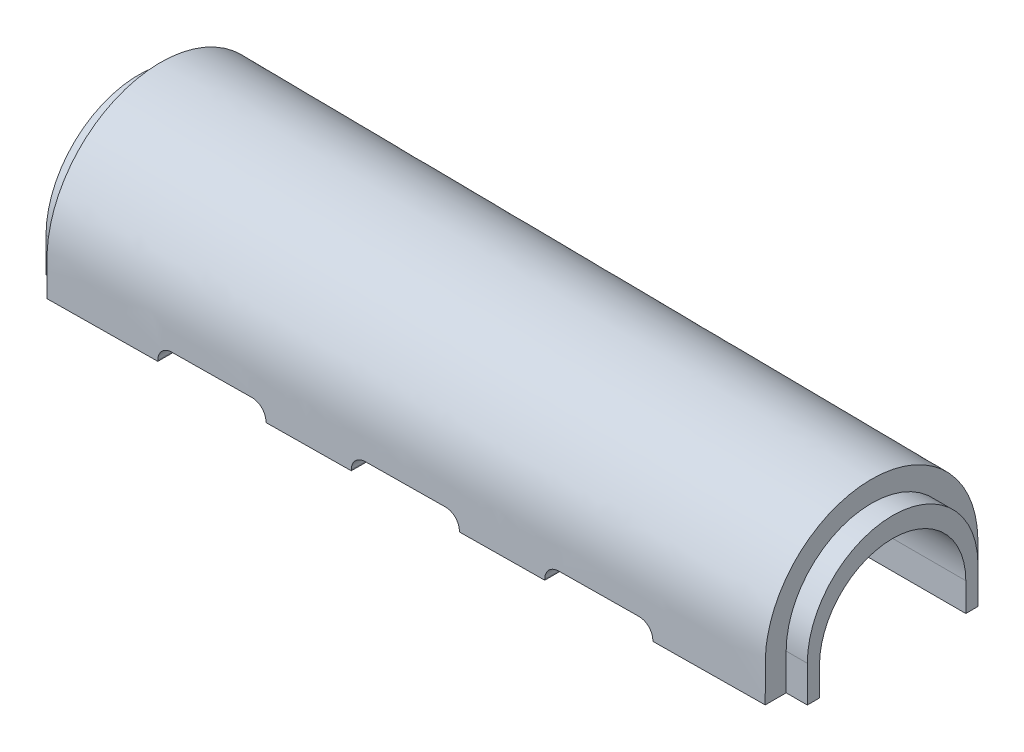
SolidWorks part; units mm, degrees
ref_plane "Front Plane" through (0, 0, 0) normal (0, 0, 1) x (1, 0, 0)
ref_plane "Top Plane" through (0, 0, 0) normal (0, 1, 0) x (1, 0, 0)
ref_plane "Right Plane" through (0, 0, 0) normal (1, 0, 0) x (0, 0, -1)
sketch "Sketch1" plane through (0, 0, 0) normal (1, 0, 0) x (0, 0, -1)
  line L1 (0, 0) -> (35.56, 0)
  line L2 (0, 0) -> (0, 5.3467)
  line L4 (35.56, 0) -> (35.56, 5.3467)
  arc A0 (0, 5.3467) -> (35.56, 5.3467) centre (17.78, 5.3467) cw
  point P6 (17.78, 23.1267)
  dimension "D2" = 23.1267
  dimension "D1" = 35.56
ref_plane "Plane1" through (117.6909, 0, 0) normal (1, 0, 0) x (0, 0, -1)
sketch "Sketch2" plane through (117.6909, 0, 0) normal (1, 0, 0) x (0, 0, -1)
  line L0 (0, 0) -> (35.56, 0) construction
  line L1 (1.2065, 0) -> (34.3535, 0)
  line L2 (1.2065, 0) -> (1.2065, 5.6515)
  line L4 (34.3535, 0) -> (34.3535, 5.6515)
  arc A0 (1.2065, 5.6515) -> (34.3535, 5.6515) centre (17.78, 5.6515) cw
  point P8 (17.78, 22.225)
  dimension "D1" = 33.147
  dimension "D2" = 16.5735
  dimension "D3" = 22.225
loft "Loft1" add profiles "Sketch1", "Sketch2"
sketch "Sketch3" plane through (0, 0, 0) normal (0, 0, 1) x (1, 0, 0)
  line L5 (20.447, -0.889) -> (37.1602, -0.889)
  line L14 (37.1602, -0.889) -> (37.1602, 0.1524)
  line L15 (22.606, 2.3114) -> (35.0012, 2.3114)
  line L16 (20.447, -0.889) -> (20.447, 0.1524)
  line L17 (50.3682, -0.889) -> (67.0814, -0.889)
  line L18 (67.0814, -0.889) -> (67.0814, 0.1524)
  line L19 (52.5272, 2.3114) -> (64.9224, 2.3114)
  line L20 (50.3682, -0.889) -> (50.3682, 0.1524)
  line L21 (80.2894, -0.889) -> (97.0026, -0.889)
  line L22 (97.0026, -0.889) -> (97.0026, 0.1524)
  line L23 (82.4484, 2.3114) -> (94.8436, 2.3114)
  line L24 (80.2894, -0.889) -> (80.2894, 0.1524)
  arc A6 (37.1602, 0.1524) -> (35.0012, 2.3114) centre (35.0012, 0.1524) ccw
  arc A7 (20.447, 0.1524) -> (22.606, 2.3114) centre (22.606, 0.1524) cw
  arc A8 (64.9224, 2.3114) -> (67.0814, 0.1524) centre (64.9224, 0.1524) cw
  arc A9 (50.3682, 0.1524) -> (52.5272, 2.3114) centre (52.5272, 0.1524) cw
  arc A10 (94.8436, 2.3114) -> (97.0026, 0.1524) centre (94.8436, 0.1524) cw
  arc A11 (80.2894, 0.1524) -> (82.4484, 2.3114) centre (82.4484, 0.1524) cw
  point P17 (96.1136, 1.4224)
  point P20 (81.1784, 1.4224)
  point P23 (66.1924, 1.4224)
  point P26 (51.2572, 1.4224)
  point P32 (21.336, 1.4224)
  dimension "D2" = 14.9352
  dimension "D3" = 14.9352
  dimension "D7" = 21.336
extrude "Cut-Extrude1" cut sketch "Sketch3" against normal through all
sketch "Sketch4" plane through (117.6909, 0, 0) normal (1, 0, 0) x (0, 0, -1)
  line L0 (1.2065, 0) -> (34.3535, 0) construction
  line L1 (4.445, 0) -> (32.6771, 0)
  line L2 (2.8829, 0) -> (2.8829, 0.9776)
  line L3 (2.8829, 0) -> (34.3535, 0)
  line L4 (1.2065, 0) -> (34.3535, 0)
  line L5 (4.445, 5.6515) -> (4.445, 3.2385)
  line L6 (4.445, 0) -> (34.3535, 0)
  line L7 (31.115, 3.2385) -> (31.115, 5.6515)
  line L8 (1.2065, 5.6515) -> (1.2065, 0)
  line L9 (1.2065, 0) -> (34.3535, 0)
  line L10 (34.3535, 0) -> (34.3535, 5.6515)
  line L11 (1.2065, 5.6515) -> (1.2065, 0)
  line L13 (34.3535, 0) -> (34.3535, 5.6515)
  line L14 (4.445, 3.2385) -> (4.445, 0)
  line L15 (4.445, 0) -> (31.115, 0)
  line L16 (31.115, 0) -> (31.115, 3.2385)
  line L17 (1.2065, 30.7745) -> (34.3535, 30.7745)
  line L18 (4.445, 3.2385) -> (31.115, 3.2385) construction
  line L19 (1.2065, 0) -> (34.3535, 0) construction
  line L22 (1.2065, 30.7745) -> (-1.6423, 30.7745)
  line L23 (1.2065, 5.6515) -> (1.2065, -4.8786)
  line L25 (1.2065, -4.8786) -> (-1.6423, -4.8786)
  line L26 (-1.6423, 30.7745) -> (-1.6423, -4.8786)
  line L27 (34.3535, 30.7745) -> (47.717, 30.7745)
  line L28 (34.3535, 5.6515) -> (34.3535, -4.8786)
  line L29 (34.3535, -4.8786) -> (47.717, -4.8786)
  line L30 (47.717, 30.7745) -> (47.717, -4.8786)
  arc A0 (34.3535, 5.6515) -> (1.2065, 5.6515) centre (17.78, 5.6515) ccw construction
  arc A1 (31.115, 5.6515) -> (4.445, 5.6515) centre (17.78, 5.6515) ccw
  arc A2 (34.3535, 5.6515) -> (1.2065, 5.6515) centre (17.78, 5.6515) ccw
  arc A5 (34.3535, 5.6515) -> (1.2065, 5.6515) centre (17.78, 5.6515) ccw construction
  point P0 (17.78, 22.225)
  dimension "D2" = 14.8971
  dimension "D3" = 0
  dimension "D4" = 3.2385
extrude "Cut-Extrude4" cut sketch "Sketch4" against normal blind 3.302
sketch "Sketch5" plane through (117.6909, 0, 0) normal (1, 0, 0) x (0, 0, -1)
  line L0 (4.445, 0) -> (31.115, 0) construction
  line L1 (6.35, 0) -> (29.21, 0)
  line L2 (6.35, 0) -> (6.35, 4.445)
  line L4 (29.21, 0) -> (29.21, 4.445)
  arc A0 (31.115, 5.6515) -> (4.445, 5.6515) centre (17.78, 5.6515) ccw construction
  arc A1 (6.35, 4.445) -> (29.21, 4.445) centre (17.78, 4.445) cw
  point P6 (17.78, 18.9865)
  point P11 (17.78, 15.875)
  dimension "D1" = 11.43
  dimension "D2" = 22.86
  dimension "D3" = 15.875
extrude "Cut-Extrude5" cut sketch "Sketch5" against normal through all
ref_plane "Plane2" through (0, 0, 0) normal (-1, 0, 0) x (0, 0, 1)
sketch "Sketch6" plane through (0, 0, 0) normal (-1, 0, 0) x (0, 0, 1)
  line L0 (-32.1434, 5.3472) -> (-32.1434, 0)
  line L1 (-29.21, 0) -> (-35.56, 0) construction
  line L2 (-3.1874, 5.3472) -> (-3.1874, 0)
  line L3 (0, 0) -> (-6.35, 0) construction
  line L4 (-32.1434, 0) -> (-32.1434, -4.0465)
  line L5 (-32.1434, -4.0465) -> (-40.3732, -4.0465)
  line L6 (-40.3732, -4.0465) -> (-40.3732, 27.6268)
  line L7 (-40.3732, 27.6268) -> (4.0188, 27.6268)
  line L8 (4.0188, 27.6268) -> (4.0188, -4.0465)
  line L9 (4.0188, -4.0465) -> (-3.1874, -4.0465)
  line L10 (-3.1874, -4.0465) -> (-3.1874, 0)
  arc A0 (0, 5.3467) -> (-35.56, 5.3467) centre (-17.78, 5.3467) ccw construction
  arc A1 (-32.1434, 5.3472) -> (-3.1874, 5.3472) centre (-17.6654, 5.3472) cw
  point P0 (-17.78, 23.1267)
  point P1 (-17.78, 19.8247)
  point P17 (-35.56, 0)
  dimension "D1" = 3.302
  dimension "D2" = 28.956
  dimension "D3" = 14.5926
extrude "Cut-Extrude6" cut sketch "Sketch6" against normal blind 3.302
